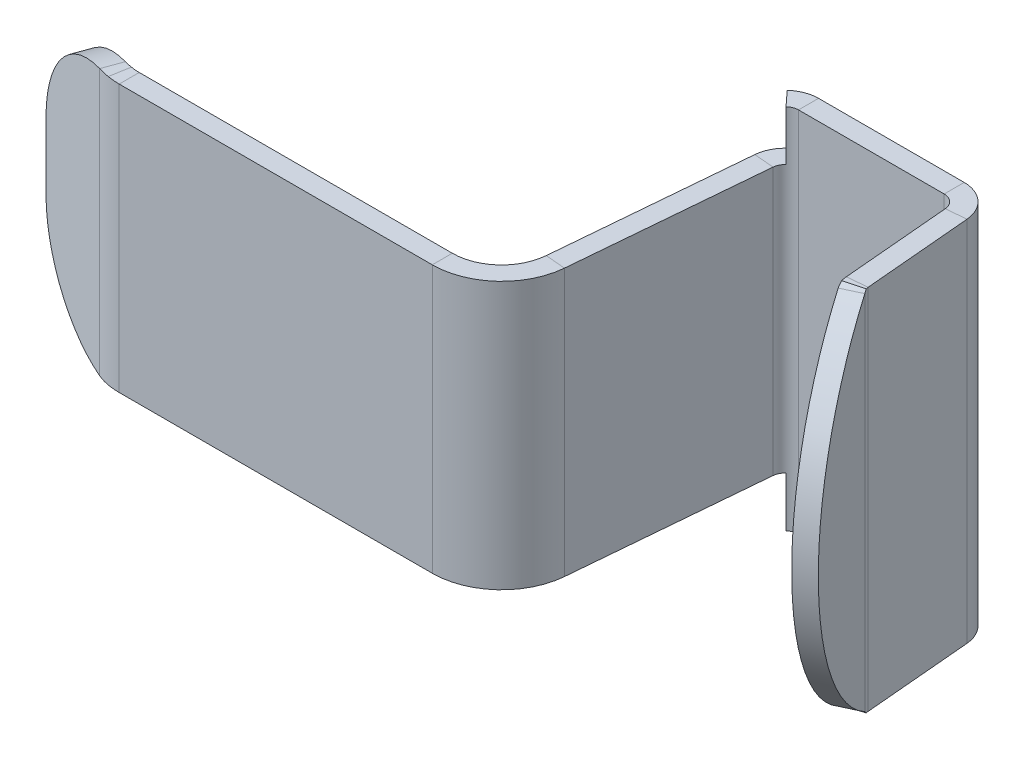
SolidWorks part; units mm, degrees
ref_plane "Plan de face" through (0, 0, 0) normal (0, 0, 1) x (1, 0, 0)
ref_plane "Plan de dessus" through (0, 0, 0) normal (0, 1, 0) x (1, 0, 0)
ref_plane "Plan de droite" through (0, 0, 0) normal (1, 0, 0) x (0, 0, -1)
sketch "Esquisse1" plane through (0, 0, 0) normal (0, 0, 1) x (1, 0, 0)
  line L0 (10.8, 4) -> (10.8, 4.75)
  line L1 (1.5, 0) -> (10.8, 0)
  line L2 (0, 1.5) -> (0, 2.5)
  line L3 (1.5, 4) -> (10.8, 4)
  line L4 (10.8, 4.75) -> (15.45, 4.75)
  line L5 (10.8, 0) -> (10.8, -0.75)
  line L6 (10.8, -0.75) -> (15.45, -0.75)
  line L7 (16.95, 9.1815) -> (16.95, -3.4793) construction
  arc A0 (15.45, 4.75) -> (15.45, -0.75) centre (13.6792, 2) cw
  arc A1 (0, 2.5) -> (1.5, 4) centre (1.5, 2.5) cw
  arc A2 (1.5, 0) -> (0, 1.5) centre (1.5, 1.5) cw
  point P14 (0, 4)
  point P17 (0, 0)
  dimension "D8" = 1.5
  dimension "D1" = 4
  dimension "D2" = 0.75
  dimension "D3" = 0.75
  dimension "D4" = 1.5
  dimension "D5" = 4.65
  dimension "D6" = 10.8
  dimension "D7" = 10.8
extrude "Extrusion1" add sketch "Esquisse1" along normal blind 0.3
sheet metal parameters "Tôlerie 1" parameters "D1"=0.7366
flatten bends "Dépliage 1" parameters "D1"=0
sketch "Esquisse-Angle1" plane through (0, 0, 0.3) normal (0, 0, 1) x (1, 0, 0)
process bends "Pliage 1" parameters "D1"=0
sketch "Esquisse-Plate1" plane through (0, 0, 0.3) normal (0, 0, 1) x (1, 0, 0)
  line L0 (15.45, 4.75) -> (15.45, -0.75)
  line L1 (10.8, 4) -> (10.8, 0)
  line L2 (13.5, 4.75) -> (13.5, -0.75)
  line L3 (15.45, 4.75) -> (10.8, 4.75) construction
  line L4 (10.8, -0.75) -> (15.45, -0.75) construction
  line L5 (1.5, 4) -> (1.5, 0)
  line L6 (7, 4) -> (7, 0)
  line L7 (10.8, 4) -> (1.5, 4) construction
  line L8 (1.5, 0) -> (10.8, 0) construction
  line L9 (0, 2.5) -> (0, 1.5) construction
  point P24 (0, 2)
  point P27 (6.2, 2)
  dimension "D1" = 2.7
  dimension "D2" = 7
bend "Pli défini à plat1" bend radius 0.7366 bend angle 20 parameters "D5"=1
bend "Pli défini à plat2" bend radius 0.7366 bend angle 85 parameters "D5"=2
bend "Pli défini à plat3" bend radius 0.2 bend angle 85 parameters "D5"=3
bend "Pli défini à plat4" bend radius 0.2 bend angle 85 parameters "D5"=4
bend "Pli défini à plat5" bend radius 0.2 bend angle 20 parameters "D5"=5
flat pattern "Etat déplié1"
sketch "Lignes de pliage1" plane through (0, 0, 0) normal (0, 1, 0) x (-1, 0, 0)
